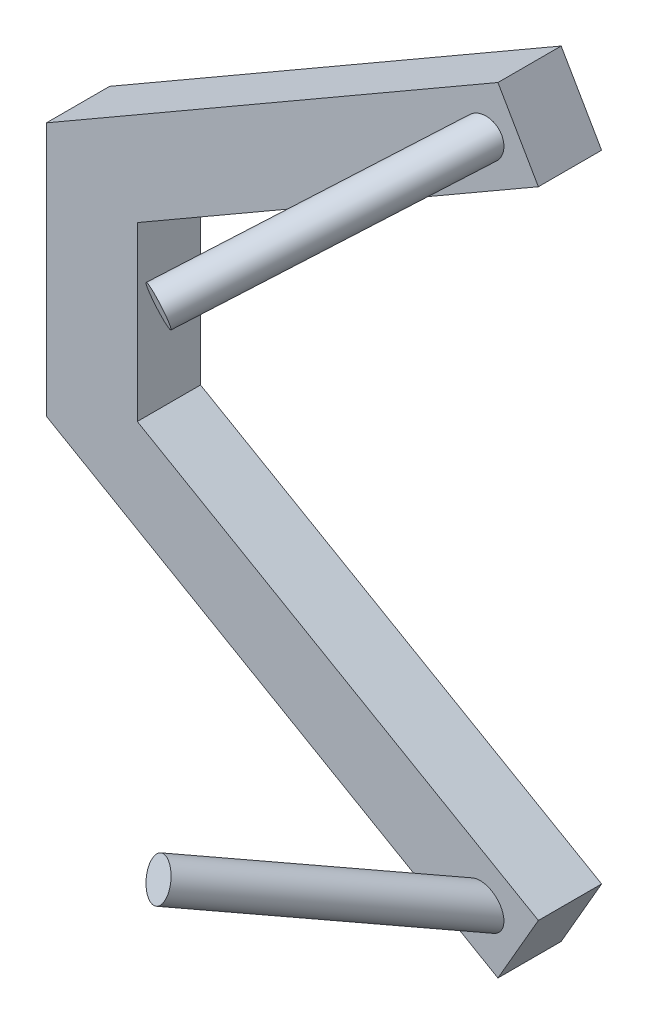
SolidWorks part; units mm, degrees
ref_plane "Ebene vorne" through (0, 0, 0) normal (0, 0, 1) x (1, 0, 0)
ref_plane "Ebene oben" through (0, 0, 0) normal (0, 1, 0) x (1, 0, 0)
ref_plane "Ebene rechts" through (0, 0, 0) normal (1, 0, 0) x (0, 0, -1)
sketch "Skizze1" plane through (0, 0, 0) normal (0, 0, 1) x (1, 0, 0)
  line L0 (0, 0) -> (143.7616, 0)
  line L1 (143.7616, 0) -> (143.7616, -136.2283)
  line L2 (143.7616, -136.2283) -> (778.0726, -502.448)
  line L3 (778.0726, -502.448) -> (714.1023, -613.2478)
  line L4 (714.1023, -613.2478) -> (0, -200.9607)
  line L5 (0, -200.9607) -> (0, 0)
  line L6 (0, 0) -> (821.3143, 0) construction
  line L7 (746.0875, -557.8479) -> (690.6876, -525.8628) construction
  line L8 (690.6876, -525.8628) -> (722.6727, -470.4628) construction
  dimension "D1" = 30
extrude "Linear austragen1" add sketch "Skizze1" against normal blind 100
ref_plane "Ebene1" through (559.2907, -322.9066, 372.8605) normal (0.75, -0.433, 0.5) x (0.433, -0.25, -0.866)
sketch "Skizze2" plane through (559.2907, -322.9066, 372.8605) normal (0.75, -0.433, 0.5) x (0.433, -0.25, -0.866)
  line L0 (430.5422, -110.0667) -> (-226.015, -52.6254)
  line L1 (430.5422, -110.0667) -> (430.5422, -46.0964) construction
  dimension "D1" = 85
ref_plane "Ebene2" through (690.6876, -525.8628, 0) normal (-0.3878, 0.3245, 0.8627) x (0.9217, 0.1365, 0.363)
sketch "Skizze3" plane through (690.6876, -525.8628, 0) normal (-0.3878, 0.3245, 0.8627) x (0.9217, 0.1365, 0.363)
  circle A0 centre (0, 0) radius 30
  dimension "D1" = 60
extrude "Linear austragen2" add sketch "Skizze3" along normal blind 410.5 and the other way up to surface
mirror "Spiegeln1" about plane through (0, 0, 0) normal (0, 1, 0)
equation "\"LÄNGE\"=0"
equation "\"BREITE\"=0"
equation "\"HÖHE\"=0"
equation "\"DURCHMESSER\"=0"
equation "\"Stückzahl\"= 1"
